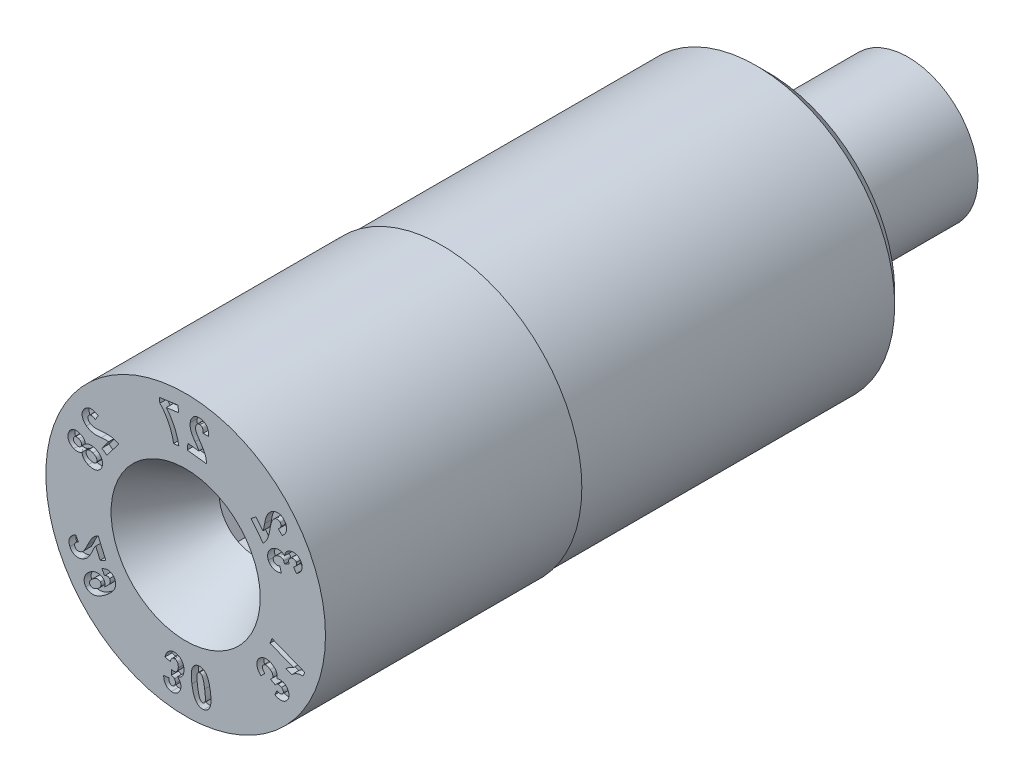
SolidWorks part; units mm, degrees
other "<M6L12-SetScrew>-<Chamfer1>"
ref_plane "Front Plane" through (0, 0, 0) normal (0, 0, 1) x (1, 0, 0)
ref_plane "Top Plane" through (0, 0, 0) normal (0, 1, 0) x (1, 0, 0)
ref_plane "Right Plane" through (0, 0, 0) normal (1, 0, 0) x (0, 0, -1)
sketch "Sketch1" plane through (0, 0, 0) normal (1, 0, 0) x (0, 0, -1)
  line L0 (0, 3.2) -> (2.9445, 1.5)
  line L2 (0, 6) -> (0, 3.2)
  line L3 (24.425, 6) -> (0, 6)
  line L4 (-3.7979, 0) -> (49996.2021, 0) construction
  line L8 (19, 1.5) -> (2.9445, 1.5)
  line L12 (25, 3) -> (25, 5.425)
  line L16 (25, 5.425) -> (24.425, 6)
  line L17 (25, 3) -> (19, 3)
  line L18 (19, 1.5) -> (19, 3)
  dimension "D1" = 25
  dimension "D2" = 45
  dimension "D3" = 0.575
  dimension "D4" = 12
  dimension "D5" = 30
  dimension "D6" = 3.2
  dimension "D7" = 3
  dimension "D8" = 6
  dimension "D9" = 6
revolve "Revolve1" add sketch "Sketch1" angle 360 about L4
sketch "Sketch5" plane through (0, 0, 0) normal (1, 0, 0) x (0, 0, -1)
  line L0 (0, 0) -> (50000, 0) construction
  line L1 (0, 6) -> (0, -6) construction
  line L2 (11, 5.935) -> (25, 5.935)
  line L3 (11, 5.935) -> (11, 6.935)
  line L4 (11, 6.935) -> (25, 6.935)
  line L5 (25, 5.935) -> (25, 6.935)
  line L6 (25, -5.425) -> (25, 5.425) construction
  line L7 (24.425, 6) -> (0, 6) construction
  dimension "D1" = 11
  dimension "D2" = 0.065
  dimension "D3" = 1
revolve "Cut-Revolve1" cut sketch "Sketch5" angle 360 about L0
sketch "Sketch2" plane through (0, 0, 0) normal (0, 0, 1) x (1, 0, 0)
  line L0 (0, 0) -> (0, 6) construction
  line L1 (0, 0) -> (5.1962, 3) construction
  line L2 (0, 0) -> (5.1962, -3) construction
  line L3 (0, 0) -> (0, -6) construction
  line L4 (0, 0) -> (-5.1962, -3) construction
  line L5 (0, 0) -> (-5.1962, 3) construction
  arc A0 (0.9318, 3.8257) -> (2.2256, 3.2482) centre (0, 0) ccw construction
  circle A1 centre (0, 0) radius 6 construction
  text T0 "27    28    29    30    31    32" font "Arial Narrow" height 1.5
  point P19 (0, 0)
  dimension "D1" = 7.875
  dimension "D2" = 6
extrude "Cut-Extrude1" cut sketch "Sketch2" against normal blind 0.3
ref_plane "Plane1" through (0, 0, -2.9445) normal (0, 0, 1) x (1, 0, 0)
sketch "Sketch6" plane through (0, 0, -2.9445) normal (0, 0, 1) x (1, 0, 0)
  line L1 (1.7321, 0) -> (0.866, 1.5)
  line L2 (0.866, 1.5) -> (-0.866, 1.5)
  line L3 (-0.866, 1.5) -> (-1.7321, 0)
  line L4 (-1.7321, 0) -> (-0.866, -1.5)
  line L5 (-0.866, -1.5) -> (0.866, -1.5)
  line L6 (0.866, -1.5) -> (1.7321, 0)
  circle A0 centre (0, 0) radius 1.5 construction
  circle A1 centre (0, 0) radius 1.5 construction
  point P1 (0, 1.5)
extrude "Cut-Extrude2" cut sketch "Sketch6" against normal blind 3
inserted part "M6L12-SetScrew"
move or copy body "Body-Move/Copy2" placed by mates yes
other "Distance1" parameters "D1"=6
